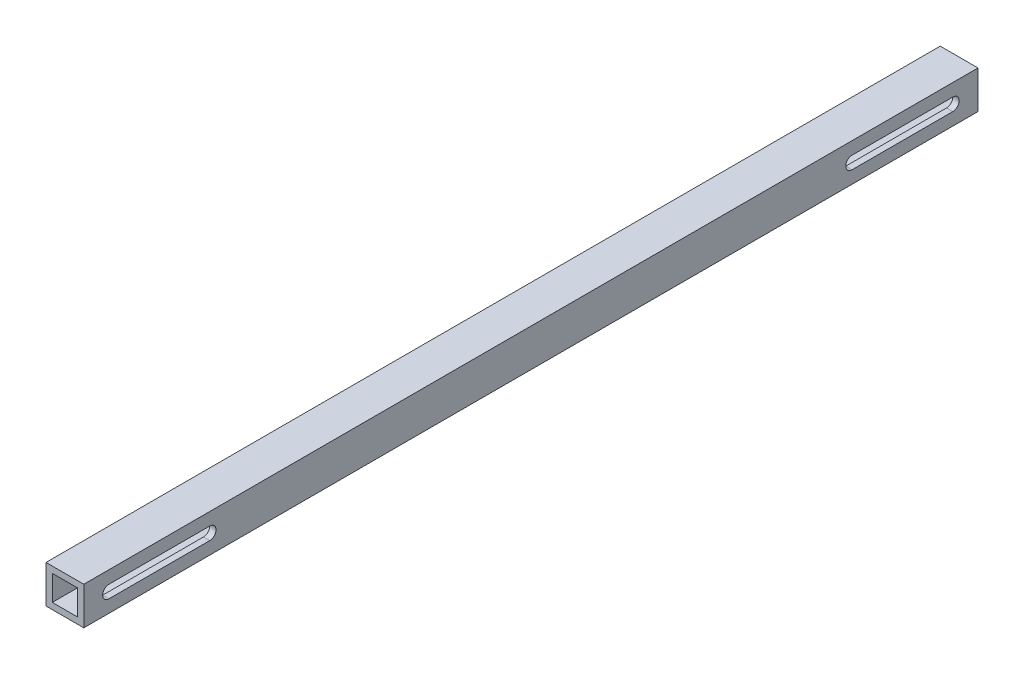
SolidWorks part; units mm, degrees
ref_plane "Front Plane" through (0, 0, 0) normal (0, 0, 1) x (1, 0, 0)
ref_plane "Top Plane" through (0, 0, 0) normal (0, 1, 0) x (1, 0, 0)
ref_plane "Right Plane" through (0, 0, 0) normal (1, 0, 0) x (0, 0, -1)
sketch "Sketch1" plane through (0, 0, 0) normal (0, 0, 1) x (1, 0, 0)
  line L0 (-6.35, 6.35) -> (6.35, 6.35)
  line L1 (-9.525, -9.525) -> (9.525, -9.525)
  line L2 (-9.525, -9.525) -> (-9.525, 9.525)
  line L3 (-9.525, 9.525) -> (9.525, 9.525)
  line L4 (9.525, -9.525) -> (9.525, 9.525)
  line L5 (-9.525, -9.525) -> (9.525, 9.525) construction
  line L6 (-9.525, 9.525) -> (9.525, -9.525) construction
  line L7 (6.35, -6.35) -> (6.35, 6.35)
  line L8 (-6.35, -6.35) -> (6.35, -6.35)
  line L9 (-6.35, -6.35) -> (-6.35, 6.35)
  point P0 (0, 0)
  dimension "D1" = 19.05
  dimension "D2" = 19.05
  dimension "D3" = 3.175
extrude "Boss-Extrude1" add sketch "Sketch1" along normal blind 450.85
sketch "Sketch2" plane through (-9.525, 0, 0) normal (-1, 0, 0) x (0, 0, 1)
  line L0 (0, 0) -> (450.85, 0) construction
  line L1 (450.85, 9.525) -> (450.85, -9.525) construction
  line L2 (12.7, 0) -> (63.5, 0) construction
  line L3 (12.7, 3.175) -> (63.5, 3.175)
  line L4 (12.7, -3.175) -> (63.5, -3.175)
  line L5 (438.15, 0) -> (387.35, 0) construction
  line L6 (438.15, -3.175) -> (387.35, -3.175)
  line L7 (438.15, 3.175) -> (387.35, 3.175)
  arc A0 (12.7, 3.175) -> (12.7, -3.175) centre (12.7, 0) ccw
  arc A1 (63.5, -3.175) -> (63.5, 3.175) centre (63.5, 0) ccw
  arc A2 (438.15, -3.175) -> (438.15, 3.175) centre (438.15, 0) ccw
  arc A3 (387.35, 3.175) -> (387.35, -3.175) centre (387.35, 0) ccw
  point P7 (38.1, 0)
  point P14 (412.75, 0)
  dimension "D2" = 3.175
  dimension "D1" = 12.7
  dimension "D3" = 12.7
  dimension "D4" = 50.8
extrude "Cut-Extrude1" cut sketch "Sketch2" against normal through all
